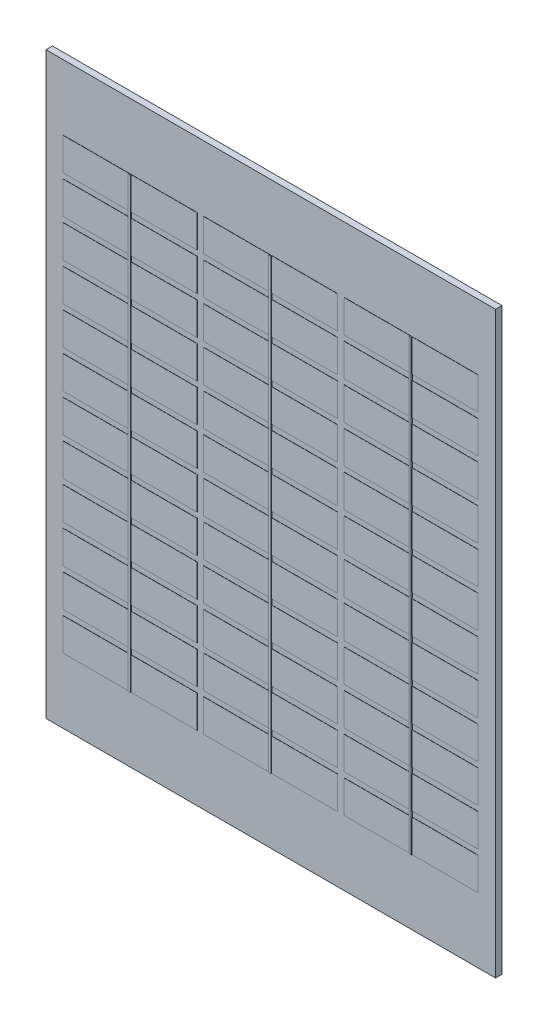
SolidWorks part; units mm, degrees
ref_plane "Plan de face" through (0, 0, 0) normal (0, 0, 1) x (1, 0, 0)
ref_plane "Plan de dessus" through (0, 0, 0) normal (0, 1, 0) x (1, 0, 0)
ref_plane "Plan de droite" through (0, 0, 0) normal (1, 0, 0) x (0, 0, -1)
imported_body "Importée1"
sketch "Esquisse1" plane through (0, 0, 0) normal (0, 0, -1) x (-1, 0, 0)
  line L0 (-208, 218) -> (-104, 218) construction
  line L1 (-124, 243) -> (-84, 243)
  line L2 (-124, 243) -> (-124, 193)
  line L3 (-124, 193) -> (-84, 193)
  line L4 (-84, 243) -> (-84, 193)
  line L5 (-124, 243) -> (-84, 193) construction
  line L6 (-124, 193) -> (-84, 243) construction
  line L7 (-208, 268) -> (-208, 0) construction
  line L8 (-104, 218) -> (0, 218) construction
  line L9 (0, 0) -> (0, 268) construction
  line L10 (0, 268) -> (-208, 268) construction
  point P0 (-104, 218)
  dimension "D1" = 40
  dimension "D2" = 50
  dimension "D3" = 50
extrude "Extrusion1" add sketch "Esquisse1" along normal blind 13
